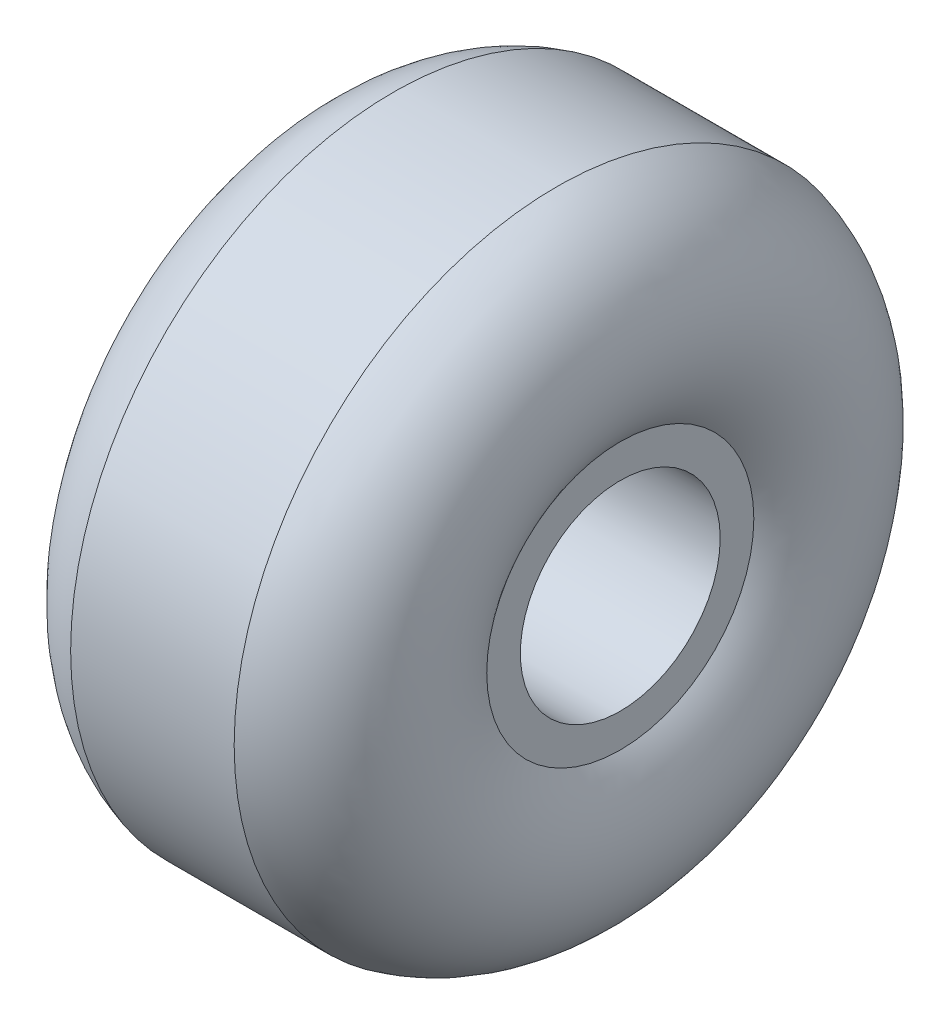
SolidWorks part; units mm, degrees
ref_plane "Front Plane" through (0, 0, 0) normal (0, 0, 1) x (1, 0, 0)
ref_plane "Top Plane" through (0, 0, 0) normal (0, 1, 0) x (1, 0, 0)
ref_plane "Right Plane" through (0, 0, 0) normal (1, 0, 0) x (0, 0, -1)
sketch "Sketch1" plane through (0, 0, 0) normal (0, 0, 1) x (1, 0, 0)
  line L0 (0, 35.5) -> (0, 0) construction
  line L1 (-16, 0) -> (16, 0)
  line L2 (0, 0) -> (0, 35.5) construction
  line L3 (-9, 35.5) -> (9, 35.5)
  line L4 (16, 0) -> (16, 14.7)
  line L5 (-16, 0) -> (-16, 14.7)
  arc A0 (9, 35.5) -> (16, 14.7) centre (5.8934, 22.8766) cw
  arc A1 (-9, 35.5) -> (-16, 14.7) centre (-5.8934, 22.8766) ccw
  dimension "D4" = 13
  dimension "D1" = 35.5
  dimension "D2" = 16
  dimension "D3" = 14.7
  dimension "D5" = 7
revolve "Revolve5" add sketch "Sketch1" angle 360 about L1
sketch "Sketch2" plane through (16, 0, 0) normal (1, 0, 0) x (0, 0, -1)
  circle A0 centre (0, 0) radius 11
  dimension "D1" = 22
extrude "Cut-Extrude1" cut sketch "Sketch2" against normal through all
